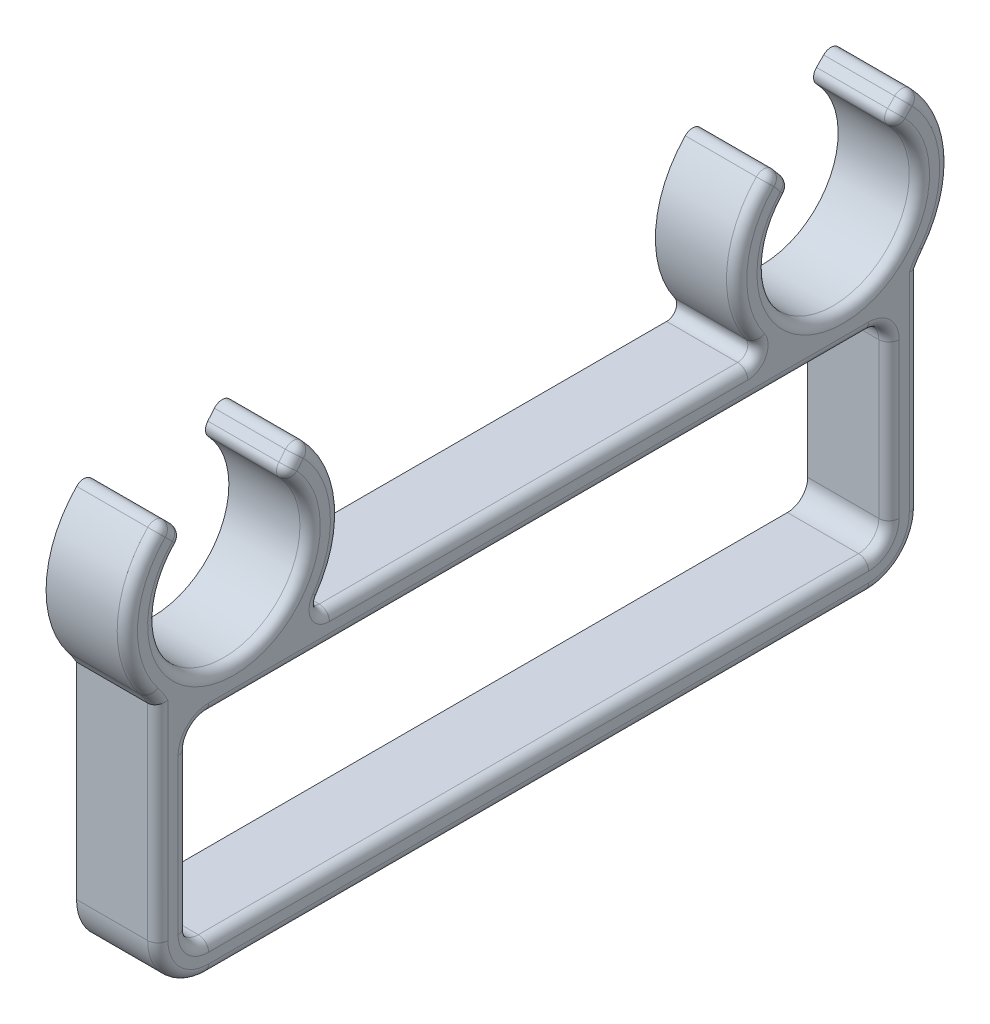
SolidWorks part; units mm, degrees
ref_plane "Front Plane" through (0, 0, 0) normal (0, 0, 1) x (1, 0, 0)
ref_plane "Top Plane" through (0, 0, 0) normal (0, 1, 0) x (1, 0, 0)
ref_plane "Right Plane" through (0, 0, 0) normal (1, 0, 0) x (0, 0, -1)
sketch "Sketch1" plane through (0, 0, 0) normal (1, 0, 0) x (0, 0, -1)
  line L0 (-37.5, 12.625) -> (37.5, 12.625)
  line L1 (-34.5, -9.625) -> (34.5, -9.625)
  line L2 (-34.5, -9.625) -> (-34.5, 9.625)
  line L3 (-34.5, 9.625) -> (34.5, 9.625)
  line L4 (34.5, -9.625) -> (34.5, 9.625)
  line L5 (-34.5, -9.625) -> (34.5, 9.625) construction
  line L6 (-34.5, 9.625) -> (34.5, -9.625) construction
  line L7 (37.5, -12.625) -> (37.5, 12.625)
  line L8 (-37.5, -12.625) -> (37.5, -12.625)
  line L9 (-37.5, -12.625) -> (-37.5, 12.625)
  point P0 (0, 0)
  dimension "D1" = 19.25
  dimension "D2" = 69
  dimension "D3" = 3
extrude "Boss-Extrude1" add sketch "Sketch1" along normal blind 8
sketch "Sketch2" plane through (0, 0, 0) normal (1, 0, 0) x (0, 0, -1)
  line L0 (0, 0) -> (0, 20.25) construction
  line L1 (0, 20.25) -> (-30, 20.25) construction
  line L2 (-30, 20.25) -> (-30, 34.047) construction
  line L4 (-34.6166, 26.1608) -> (-36.7493, 28.2935)
  line L5 (-25.1791, 25.9953) -> (-23.2507, 28.2935)
  line L6 (25.1791, 25.9953) -> (23.2507, 28.2935)
  line L7 (34.6166, 26.1608) -> (36.7493, 28.2935)
  arc A0 (-34.6166, 26.1608) -> (-25.1791, 25.9953) centre (-30, 20.25) ccw
  arc A1 (-36.7493, 28.2935) -> (-23.2507, 28.2935) centre (-30, 20.25) ccw
  arc A2 (34.6166, 26.1608) -> (25.1791, 25.9953) centre (30, 20.25) cw
  arc A3 (36.7493, 28.2935) -> (23.2507, 28.2935) centre (30, 20.25) cw
  circle A4 centre (-30, 20.25) radius 7.5 construction
  circle A5 centre (-30, 20.25) radius 10.5 construction
  dimension "D3" = 3
  dimension "D1" = 30
  dimension "D2" = 20.25
  dimension "D4" = 45
extrude "Boss-Extrude2" add sketch "Sketch2" along normal blind 8
fillet "Fillet1" radius 2 4 edges at (4, -9.625, -34.5) (4, 9.625, -34.5) (4, -9.625, 34.5) (4, 9.625, 34.5)
fillet "Fillet2" radius 5 2 edges at (4, -12.625, -37.5) (4, -12.625, 37.5)
fillet "Fillet3" radius 10 2 edges at (4, 12.625, -37.2187) (4, 12.625, 37.2187)
fillet "Fillet4" radius 1 2 edges at (4, 12.625, -22.7813) (4, 12.625, 22.7813)
fillet "Fillet5" radius 1 8 edges at (4, 28.2935, -36.7493) (4, 26.1608, -34.6166) (4, 25.9953, -25.1791) (4, 28.2935, -23.2507) (4, 28.2935, 23.2507) (4, 25.9953, 25.1791) (4, 28.2935, 36.7493) (4, 26.1608, 34.6166)
fillet "Fillet6" radius 1 36 edges at (8, 9.0392, -33.9142) (8, 0, -34.5) (8, -9.0392, -33.9142) (8, -9.625, 0) (8, -9.0392, 33.9142) (8, 0, 34.5) (8, 9.0392, 33.9142) (8, 13.1646, -21.4878) (8, 21.0539, -19.5308) (8, 27.8436, -23.1959) (8, 27.1016, -24.2508) (8, 26.0451, -24.8078) (8, 12.7504, -30.0775) (8, 26.2051, -35.0701) (8, 27.2608, -35.7166) (8, 27.9072, -36.7817) (8, 20.8573, -40.4824) (8, 2.5, -37.5) (8, -11.1605, -36.0355) (8, -12.625, 0) (8, -11.1605, 36.0355) (8, 2.5, 37.5) (8, 20.8573, 40.4824) (8, 27.9072, 36.7817) (8, 27.2608, 35.7166) (8, 26.2051, 35.0701) (8, 12.7504, 30.0775) (8, 26.0451, 24.8078) (8, 27.1016, 24.2508) (8, 27.8436, 23.1959) (8, 21.0539, 19.5308) (8, 13.1646, 21.4878) (8, 9.625, 0) (8, 12.625, 0) (8, 13.2297, -37.8741) (8, 13.2297, 37.8741)
